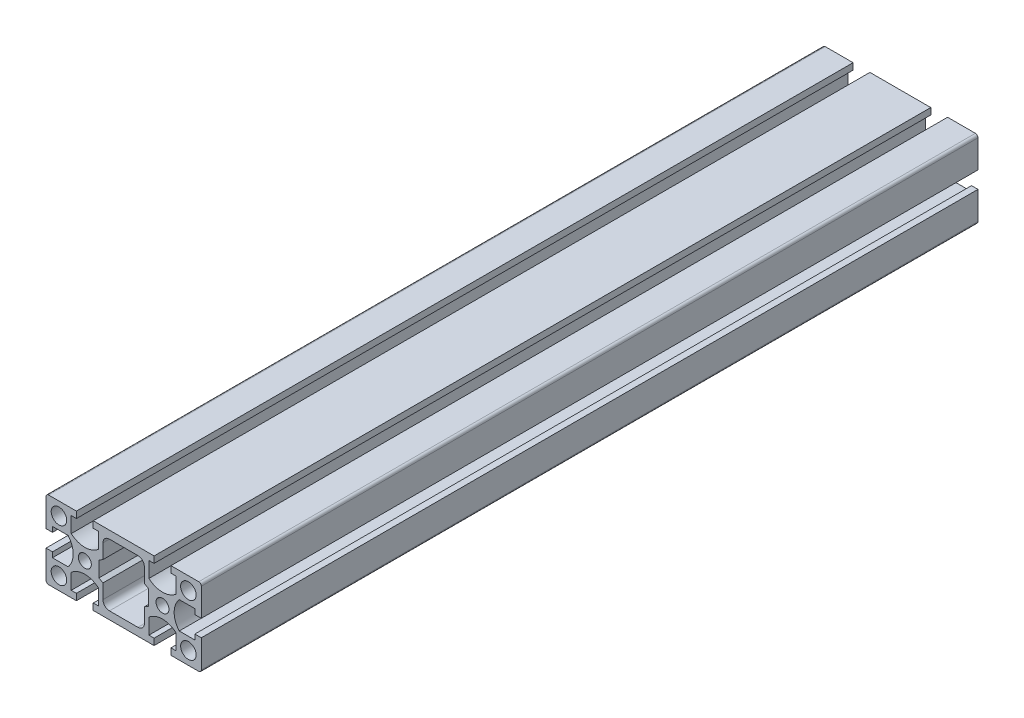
SolidWorks part; units mm, degrees
ref_plane "前视基准面" through (0, 0, 0) normal (0, 0, 1) x (1, 0, 0)
ref_plane "上视基准面" through (0, 0, 0) normal (0, 1, 0) x (1, 0, 0)
ref_plane "右视基准面" through (0, 0, 0) normal (1, 0, 0) x (0, 0, -1)
sketch "草图1"
sketch_block_instance "A$C54DD7205-1"
sketch_block "A$C54DD7205"
extrude "凸台-拉伸1" add sketch "草图1" along normal mid plane 300
